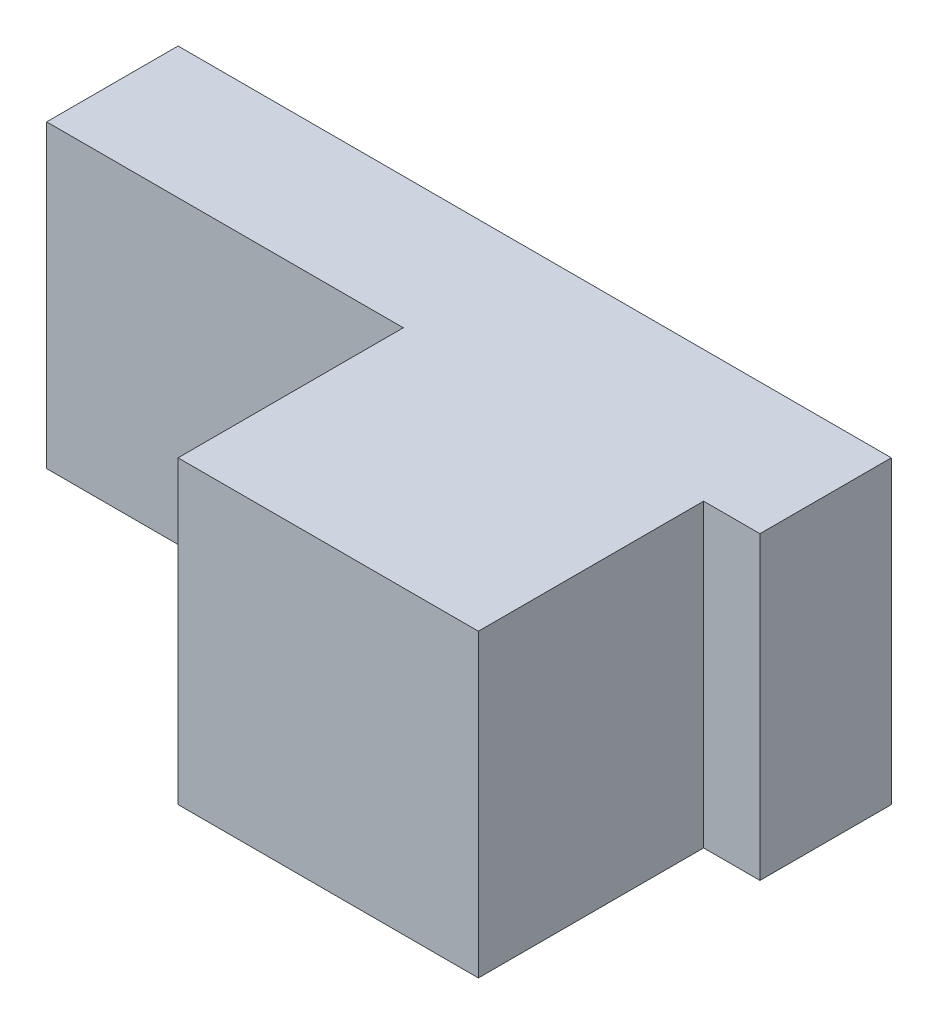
SolidWorks part; units mm, degrees
ref_plane "Plan de face" through (0, 0, 0) normal (0, 0, 1) x (1, 0, 0)
ref_plane "Plan de dessus" through (0, 0, 0) normal (0, 1, 0) x (1, 0, 0)
ref_plane "Plan de droite" through (0, 0, 0) normal (1, 0, 0) x (0, 0, -1)
sketch "Esquisse1" plane through (0, 0, 0) normal (0, 0, 1) x (1, 0, 0)
  line L1 (-9.5, 4) -> (9.5, 4)
  line L2 (-9.5, 4) -> (-9.5, -4)
  line L3 (-9.5, -4) -> (9.5, -4)
  line L4 (9.5, 4) -> (9.5, -4)
  dimension "D1" = 19
  dimension "D2" = 8
  dimension "D3" = 9.5
  dimension "D4" = 4
extrude "Extrusion1" add sketch "Esquisse1" along normal blind 3.5
sketch "Esquisse2" plane through (0, 0, 3.5) normal (0, 0, 1) x (1, 0, 0)
  line L0 (9.5, 4) -> (-9.5, 4) construction
  line L1 (0, 4) -> (8, 4)
  line L2 (0, 4) -> (0, -4)
  line L3 (0, -4) -> (8, -4)
  line L4 (8, 4) -> (8, -4)
  line L5 (-9.5, -4) -> (9.5, -4) construction
  line L6 (9.5, -4) -> (9.5, 4) construction
  dimension "D1" = 8
  dimension "D2" = 1.5
extrude "Extrusion2" add sketch "Esquisse2" along normal blind 6
